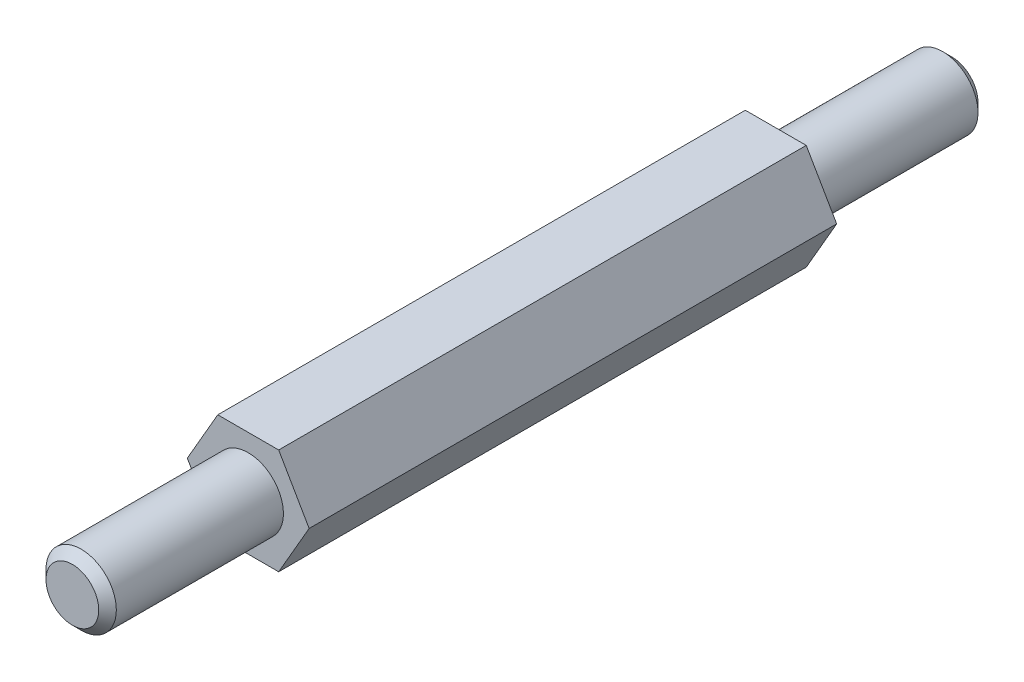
SolidWorks part; units mm, degrees
ref_plane "Plan de face" through (0, 0, 0) normal (0, 0, 1) x (1, 0, 0)
ref_plane "Plan de dessus" through (0, 0, 0) normal (0, 1, 0) x (1, 0, 0)
ref_plane "Plan de droite" through (0, 0, 0) normal (1, 0, 0) x (0, 0, -1)
sketch "Esquisse1" plane through (0, 0, 0) normal (0, 0, 1) x (1, 0, 0)
  line L0 (-3.4641, 0) -> (-1.7321, 3)
  line L1 (1.7321, 3) -> (3.4641, 0)
  line L2 (3.4641, 0) -> (1.7321, -3)
  line L3 (1.7321, -3) -> (-1.7321, -3)
  line L4 (-1.7321, -3) -> (-3.4641, 0)
  line L5 (-1.7321, 3) -> (1.7321, 3)
  line L6 (0, 0) -> (18.9678, 0) construction
  line L7 (0, 0) -> (0, 16.1728) construction
  dimension "D1" = 6
  dimension "D2" = 6
extrude "Boss.-Extru.1" add sketch "Esquisse1" along normal blind 30
sketch "Esquisse2" plane through (0, 0, 30) normal (0, 0, 1) x (1, 0, 0)
  circle A0 centre (0, 0) radius 2
extrude "Boss.-Extru.2" add sketch "Esquisse2" along normal blind 10
sketch "Esquisse3" plane through (0, 0, 0) normal (0, 0, -1) x (-1, 0, 0)
  circle A0 centre (0, 0) radius 2
extrude "Boss.-Extru.3" add sketch "Esquisse3" along normal blind 10
chamfer "Chanfrein1" distance 0.5 angle 45 2 edges at (2, 0, 40) (-2, 0, -10)
